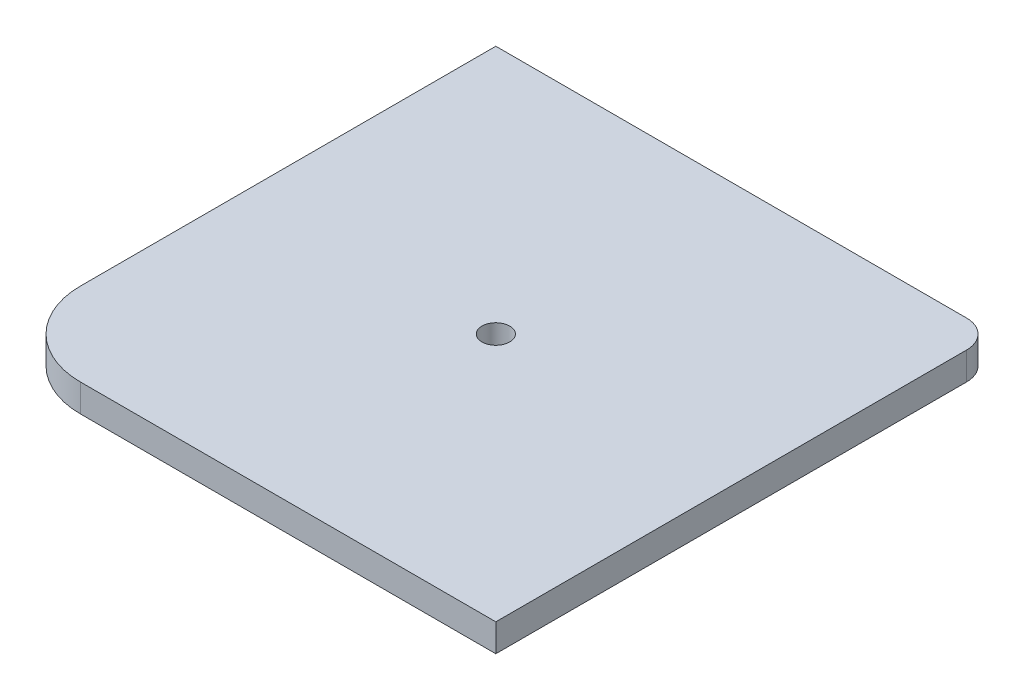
SolidWorks part; units mm, degrees
ref_plane "Front" through (0, 0, 0) normal (0, 0, 1) x (1, 0, 0)
ref_plane "Top" through (0, 0, 0) normal (0, 1, 0) x (1, 0, 0)
ref_plane "Right" through (0, 0, 0) normal (1, 0, 0) x (0, 0, -1)
sketch "Sketch1" plane through (0, 0, 0) normal (0, 1, 0) x (1, 0, 0)
  line L1 (15, 0) -> (90, 0)
  line L2 (0, 15) -> (0, 90)
  line L3 (0, 90) -> (85, 90)
  line L4 (90, 0) -> (90, 85)
  circle A0 centre (45, 45) radius 2.5
  arc A1 (15, 0) -> (0, 15) centre (15, 15) cw
  arc A2 (90, 85) -> (85, 90) centre (85, 85) ccw
  point P9 (0, 0)
extrude "Extrude1" add sketch "Sketch1" along normal blind 5
